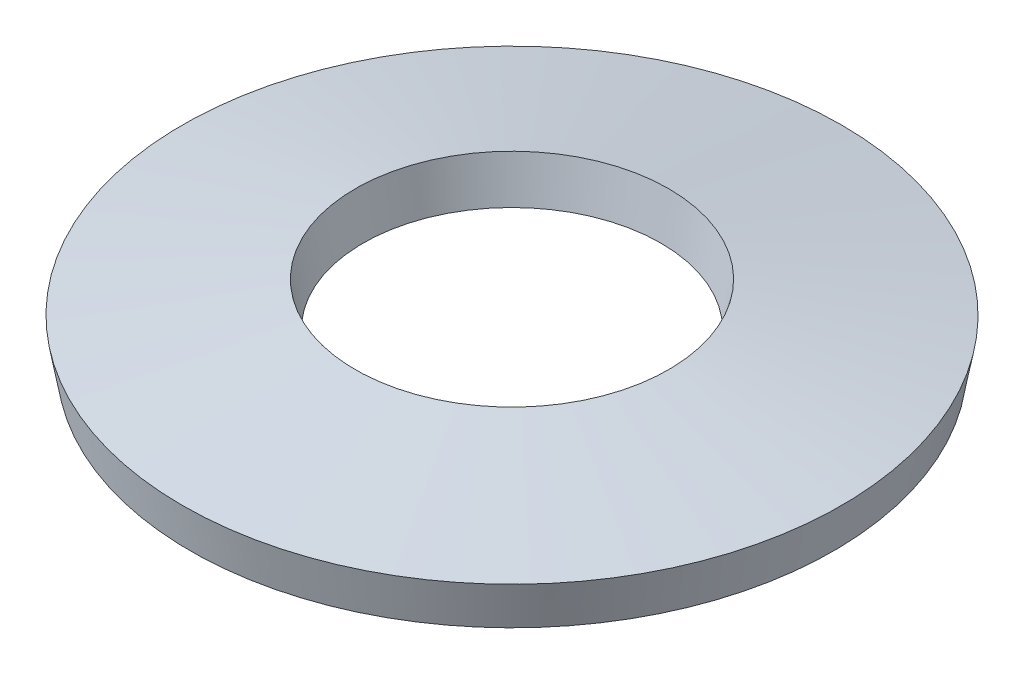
SolidWorks part; units mm, degrees
ref_plane "Plan de face" through (0, 0, 0) normal (0, 0, 1) x (1, 0, 0)
ref_plane "Plan de dessus" through (0, 0, 0) normal (0, 1, 0) x (1, 0, 0)
ref_plane "Plan de droite" through (0, 0, 0) normal (1, 0, 0) x (0, 0, -1)
sketch "Esquisse1" plane through (0, 0, 0) normal (0, 0, 1) x (1, 0, 0)
  line L0 (6.4199, 3.05) -> (6.1, 1.2787)
  line L1 (6.1, 1.2787) -> (13.1801, 0)
  line L2 (13.1801, 0) -> (13.5, 1.7713)
  line L3 (13.5, 1.7713) -> (6.4199, 3.05)
  line L4 (0, 0) -> (0, 54.9683) construction
  dimension "D1" = 1.8
  dimension "D2" = 6.1
  dimension "D3" = 3.05
  dimension "D4" = 13.5
revolve "Révolution1" add sketch "Esquisse1" angle 360 about L4
